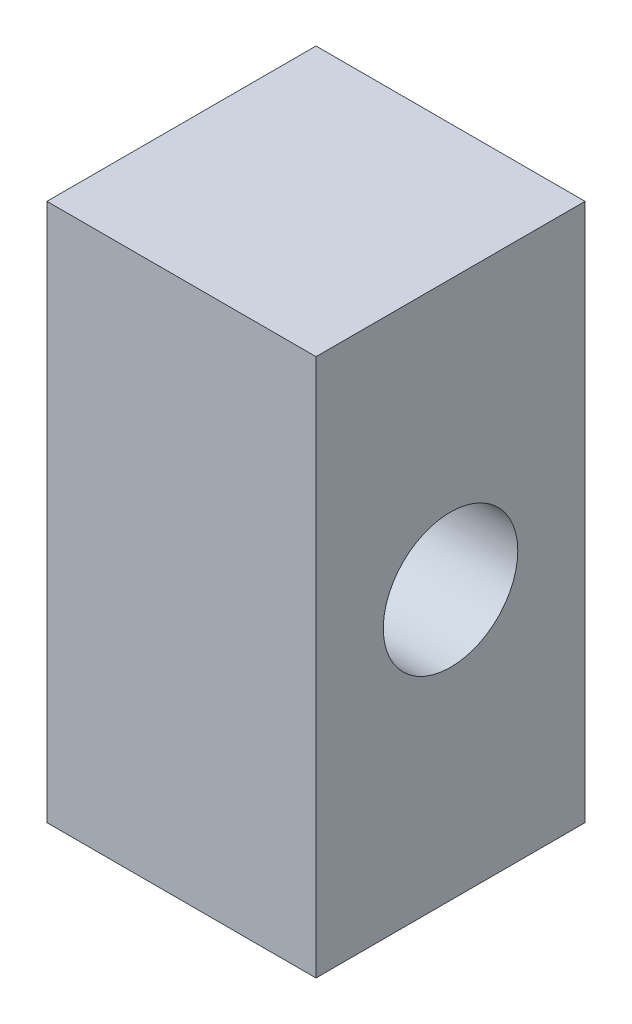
SolidWorks part; units mm, degrees
ref_plane "Front" through (0, 0, 0) normal (0, 0, 1) x (1, 0, 0)
ref_plane "Top" through (0, 0, 0) normal (0, 1, 0) x (1, 0, 0)
ref_plane "Right" through (0, 0, 0) normal (1, 0, 0) x (0, 0, -1)
sketch "Schizzo1" plane through (0, 0, 0) normal (0, 0, 1) x (1, 0, 0)
  line L1 (20, -40) -> (-20, -40)
  line L2 (20, -40) -> (20, 40)
  line L3 (20, 40) -> (-20, 40)
  line L4 (-20, -40) -> (-20, 40)
  line L5 (20, -40) -> (-20, 40) construction
  line L6 (20, 40) -> (-20, -40) construction
  point P0 (0, 0)
  point P6 (0, 0)
  dimension "D1" = 40
  dimension "D2" = 80
extrude "Estrusione-Estrusione1" add sketch "Schizzo1" along normal mid plane 40
sketch "Schizzo2" plane through (20, 0, 0) normal (1, 0, 0) x (0, 0, -1)
  circle A0 centre (0, 0) radius 10
  dimension "D1" = 20
extrude "Taglio-Estrusione1" cut sketch "Schizzo2" against normal blind 40
